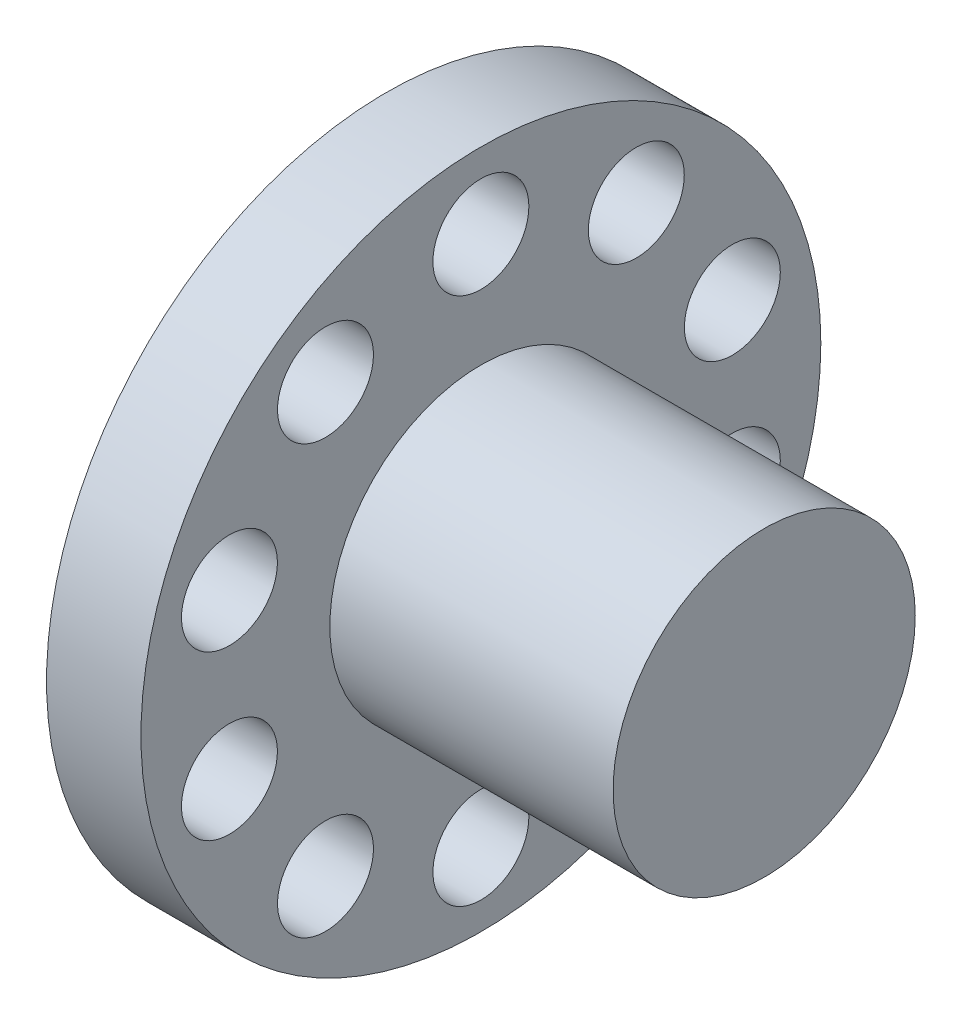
SolidWorks part; units mm, degrees
ref_plane "Płaszczyzna przednia" through (0, 0, 0) normal (0, 0, 1) x (1, 0, 0)
ref_plane "Płaszczyzna górna" through (0, 0, 0) normal (0, 1, 0) x (1, 0, 0)
ref_plane "Płaszczyzna prawa" through (0, 0, 0) normal (1, 0, 0) x (0, 0, -1)
sketch "Szkic bazowy" plane through (0, 0, 0) normal (0, 0, 1) x (1, 0, 0)
  line L0 (0, 0) -> (-52.1059, 0) construction
  line L1 (0, 0) -> (0, 90)
  line L2 (0, 90) -> (25, 90)
  line L3 (25, 90) -> (25, 40)
  line L4 (25, 40) -> (100, 40)
  line L5 (100, 40) -> (100, 0)
  line L6 (100, 0) -> (0, 0)
  dimension "D1" = 180
  dimension "D2" = 80
  dimension "D3" = 25
  dimension "Długość" = 100
revolve "Obrót bazowy" add sketch "Szkic bazowy" angle 360 about L0
sketch "Szkic otworu środkowego" plane through (100, 0, 0) normal (1, 0, 0) x (0, 0, -1)
  circle A0 centre (0, 0) radius 20
  dimension "D1" = 40
extrude "Otwór środkowy" [suppressed] cut sketch "Szkic otworu środkowego" against normal through all
sketch "Szkic otworu mocowania" plane through (0, 0, 0) normal (-1, 0, 0) x (0, 0, 1)
  circle A6 centre (0, 0) radius 70 construction
  circle A7 centre (0, 70) radius 12.7
  dimension "Średnica osadzenia" = 140
  dimension "Średnica otworu" = 25.4
extrude "Otwór mocowania" cut sketch "Szkic otworu mocowania" against normal through all
pattern_circular "Powielenie otworów" count 10 over 360 about axis through (0, 0, 0) along (1, 0, 0) of "Otwór mocowania"
